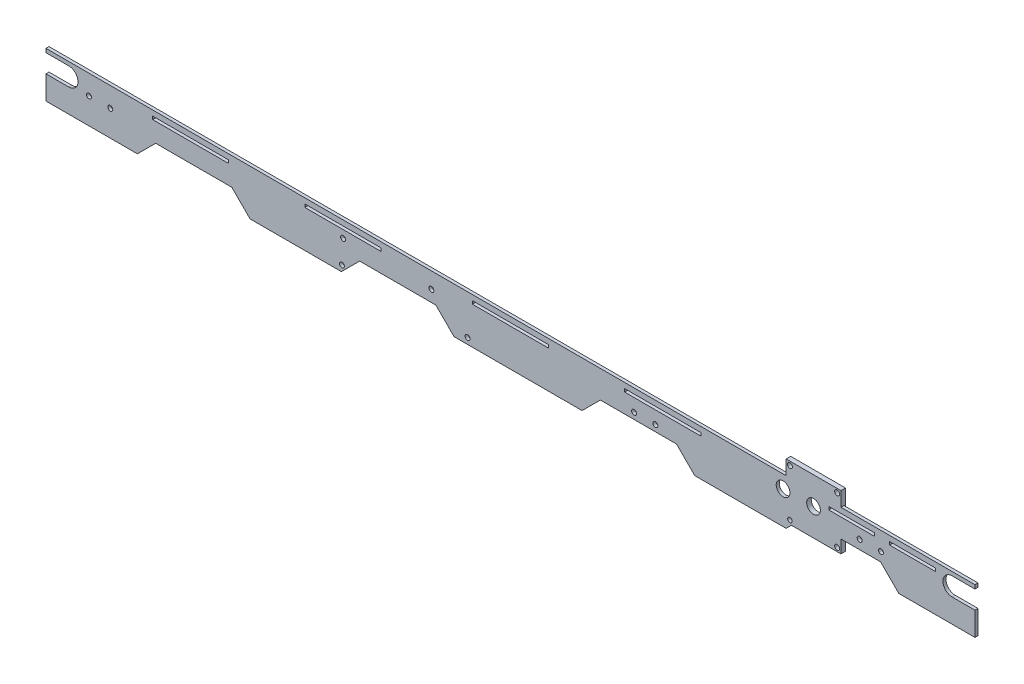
SolidWorks part; units mm, degrees
ref_plane "Front Plane" through (0, 0, 0) normal (0, 0, 1) x (1, 0, 0)
ref_plane "Top Plane" through (0, 0, 0) normal (0, 1, 0) x (1, 0, 0)
ref_plane "Right Plane" through (0, 0, 0) normal (1, 0, 0) x (0, 0, -1)
sketch "Croquis1" plane through (0, 0, 0) normal (0, 0, 1) x (1, 0, 0)
  line L0 (-300, 3) -> (300, 3)
  line L5 (300, 3) -> (300, -27)
  line L6 (300, -27) -> (250, -27)
  line L7 (250, -27) -> (238, -15)
  line L8 (238, -15) -> (188, -15)
  line L9 (188, -15) -> (176, -27)
  line L10 (176, -27) -> (116.02, -27) construction
  line L11 (116.02, -27) -> (104.02, -15)
  line L12 (104.02, -15) -> (54.02, -15)
  line L13 (54.02, -15) -> (42.02, -27)
  line L14 (42.02, -27) -> (-42.02, -27)
  line L15 (0, 0) -> (0, -27) construction
  line L16 (116.02, -27) -> (176, -27)
  line L17 (-176, -27) -> (-116.02, -27) construction
  line L18 (-116.02, -27) -> (-176, -27)
  line L19 (-54.02, -15) -> (-42.02, -27)
  line L20 (-104.02, -15) -> (-54.02, -15)
  line L21 (-116.02, -27) -> (-104.02, -15)
  line L22 (-188, -15) -> (-176, -27)
  line L23 (-238, -15) -> (-188, -15)
  line L24 (-250, -27) -> (-238, -15)
  line L25 (-300, -27) -> (-250, -27)
  line L26 (-300, 3) -> (-300, -27)
  dimension "D1" = 30
  dimension "D2" = 18
  dimension "D3" = 45
  dimension "D4" = 45
  dimension "D5" = 45
  dimension "D6" = 45
  dimension "D7" = 50
  dimension "D8" = 300
  dimension "D9" = 50
  dimension "D10" = 50
  dimension "D11" = 42.02
  dimension "D12" = 59.98
  dimension "D13" = 18
  dimension "D14" = 18
  dimension "D15" = 18
  dimension "D16" = 3
  dimension "D17" = 30
  dimension "D18" = 30
  dimension "D19" = 30
  dimension "D20" = 30
  dimension "D21" = 30
extrude "Saliente-Extruir1" add sketch "Croquis1" along normal blind 2
sketch "Croquis4" plane through (0, 0, 2) normal (0, 0, 1) x (1, 0, 0)
  line L0 (-300, 3) -> (-300, -27) construction
  line L1 (-240, -0.5) -> (-190, -0.5)
  line L2 (-240, -0.5) -> (-240, -2.5)
  line L3 (-240, -2.5) -> (-190, -2.5)
  line L4 (-190, -0.5) -> (-190, -2.5)
  line L5 (-140, -0.5) -> (-90, -0.5)
  line L6 (-140, -0.5) -> (-140, -2.5)
  line L7 (-140, -2.5) -> (-90, -2.5)
  line L8 (-90, -0.5) -> (-90, -2.5)
  line L9 (-30, -0.5) -> (20, -0.5)
  line L10 (-30, -0.5) -> (-30, -2.5)
  line L11 (-30, -2.5) -> (20, -2.5)
  line L12 (20, -0.5) -> (20, -2.5)
  line L13 (70, -0.5) -> (120, -0.5)
  line L14 (70, -0.5) -> (70, -2.5)
  line L15 (70, -2.5) -> (120, -2.5)
  line L16 (120, -0.5) -> (120, -2.5)
  line L17 (120, -1.5) -> (-370.2291, -1.5) construction
  line L18 (300, 3) -> (-300, 3) construction
  dimension "D1" = 2
  dimension "D2" = 60
  dimension "D3" = 50
  dimension "D4" = 50
  dimension "D5" = 50
  dimension "D6" = 50
  dimension "D7" = 50
  dimension "D8" = 50
  dimension "D9" = 60
  dimension "D10" = 3.5
  dimension "D11" = 2
  dimension "D12" = 3.5
  dimension "D13" = 2
  dimension "D14" = 3.5
  dimension "D15" = 2
  dimension "D16" = 3.5
extrude "Cortar-Extruir1" cut sketch "Croquis4" against normal blind 5
sketch "Croquis6" plane through (0, 0, 0) normal (0, 0, -1) x (-1, 0, 0)
  line L0 (-117.3884, -5.5) -> (-221.61, -5.5) construction
  line L2 (-70, -0.5) -> (-120, -0.5) construction
  line L3 (-120, -0.5) -> (-120, -2.5) construction
  circle A0 centre (-194, -5.5) radius 4.5
  dimension "D2" = 9
  dimension "D1" = 5
  dimension "D3" = 74
extrude "Cortar-Extruir3" cut sketch "Croquis6" against normal blind 3
sketch "Croquis7" plane through (0, 0, 2) normal (0, 0, 1) x (1, 0, 0)
  line L0 (178.5, 10) -> (240.5, 10) construction
  line L1 (176, -23.5) -> (212, -23.5)
  line L2 (176, -23.5) -> (176, 12.5)
  line L3 (176, 12.5) -> (212, 12.5)
  line L4 (212, -23.5) -> (212, 12.5)
  line L5 (176, -23.5) -> (212, 12.5) construction
  line L6 (176, 12.5) -> (212, -23.5) construction
  line L7 (212, 20.7798) -> (212, -35.4655) construction
  circle A0 centre (194, -5.5) radius 4.5
  circle A1 centre (194, -5.5) radius 4.5 construction
  circle A2 centre (178.5, 10) radius 1.625
  circle A3 centre (209.5, 10) radius 1.625
  circle A5 centre (209.5, -21) radius 1.625
  circle A7 centre (178.5, -21) radius 1.625
  point P2 (194, -5.5)
  dimension "D1" = 36
  dimension "D3" = 31
  dimension "D4" = 3.25
  dimension "D5" = 3.25
  dimension "D6" = 31
  dimension "D2" = 36
  dimension "D7" = 31
  dimension "D8" = 31
extrude "Saliente-Extruir2" add sketch "Croquis7" against normal blind 3
sketch "Croquis8" plane through (0, 0, 2) normal (0, 0, 1) x (1, 0, 0)
  line L0 (194, -5.5) -> (137.4416, -5.5) construction
  line L3 (231.4504, 47.2218) -> (231.4504, -51.8002) construction
  circle A0 centre (178.5, 10) radius 1.5
  circle A1 centre (194, -5.5) radius 3.6
  circle A2 centre (178.5, -21) radius 1.5
extrude "Cortar-Extruir4" cut sketch "Croquis8" against normal blind 3
sketch "Croquis10" plane through (0, 0, 2) normal (0, 0, 1) x (1, 0, 0)
  line L1 (-300, 3) -> (-310, 3)
  line L2 (-300, 3) -> (-300, -27)
  line L3 (-300, -27) -> (-310, -27)
  line L4 (-310, 3) -> (-310, -27)
  dimension "D1" = 10
  dimension "D2" = 30
extrude "Saliente-Extruir3" add sketch "Croquis10" against normal blind 2
sketch "Croquis20" plane through (0, 0, 0) normal (0, 0, -1) x (-1, 0, 0)
  circle A0 centre (114.9351, -7.5) radius 1.625
  circle A1 centre (56.9351, -7.5) radius 1.625
  dimension "D1" = 3.25
  dimension "D2" = 3.25
extrude "Cortar-Extruir15" cut sketch "Croquis20" against normal blind 10
sketch "Croquis21" plane through (0, 0, 0) normal (0, 0, -1) x (-1, 0, 0)
  line L0 (-90.1377, -10.8839) -> (-76.1377, -10.8839) construction
  circle A0 centre (-76.1377, -10.8839) radius 1.625
  circle A1 centre (-90.1377, -10.8839) radius 1.625
  dimension "D1" = 3.25
  dimension "D2" = 3.25
  dimension "D3" = 14
extrude "Cortar-Extruir16" cut sketch "Croquis21" against normal blind 3
sketch "Croquis22" plane through (0, 0, 2) normal (0, 0, 1) x (1, 0, 0)
  circle A0 centre (224.2734, -9) radius 1.625
  circle A1 centre (238.2734, -9) radius 1.625
  dimension "D1" = 3.25
  dimension "D2" = 3.25
extrude "Cortar-Extruir17" cut sketch "Croquis22" against normal blind 3
sketch "Croquis23" plane through (0, 0, 2) normal (0, 0, 1) x (1, 0, 0)
  line L0 (-281.7723, -10) -> (-267.7723, -10) construction
  line L1 (176, 3) -> (-310, 3) construction
  circle A0 centre (-281.7723, -10) radius 1.625
  circle A1 centre (-267.7723, -10) radius 1.625
  dimension "D1" = 3.25
  dimension "D2" = 3.25
  dimension "D3" = 13
extrude "Cortar-Extruir18" cut sketch "Croquis23" against normal blind 3
sketch "Croquis25" plane through (0, 0, 2) normal (0, 0, 1) x (1, 0, 0)
  line L0 (-295, 0.5) -> (-310, 0.5)
  line L1 (-310, 3) -> (-310, -27) construction
  line L2 (-310, 0.5) -> (-310, -11.5)
  line L3 (-310, -11.5) -> (-295, -11.5)
  line L4 (-190, -0.5) -> (-240, -0.5) construction
  line L5 (-5, 29.772) -> (-5, -143.3003) construction
  line L7 (300, -11.5) -> (285, -11.5)
  line L8 (300, 0.5) -> (300, -11.5)
  line L9 (285, 0.5) -> (300, 0.5)
  arc A0 (-295, -11.5) -> (-295, 0.5) centre (-295, -5.5) ccw
  arc A1 (285, -11.5) -> (285, 0.5) centre (285, -5.5) cw
  point P1 (-289, -5.5)
  point P19 (279, -5.5)
  dimension "D1" = 12
  dimension "D2" = 15
  dimension "D3" = 21
  dimension "D4" = 5
  dimension "D5" = 5
extrude "Cortar-Extruir20" cut sketch "Croquis25" against normal blind 3
sketch "Croquis27" plane through (0, 0, 2) normal (0, 0, 1) x (1, 0, 0)
  circle A0 centre (174, -5.5) radius 4.5
  dimension "D1" = 9
extrude "Cortar-Extruir21" cut sketch "Croquis27" against normal blind 3
sketch "Croquis28" plane through (0, 0, 0) normal (0, 0, -1) x (-1, 0, 0)
  line L0 (-204, -1.5) -> (-303.6264, -1.5) construction
  line L1 (-274, -0.5) -> (-244, -0.5)
  line L2 (-274, -0.5) -> (-274, -2.5)
  line L3 (-274, -2.5) -> (-244, -2.5)
  line L4 (-244, -0.5) -> (-244, -2.5)
  line L5 (-234, -0.5) -> (-204, -0.5)
  line L6 (-234, -0.5) -> (-234, -2.5)
  line L7 (-234, -2.5) -> (-204, -2.5)
  line L8 (-204, -0.5) -> (-204, -2.5)
  dimension "D1" = 2
  dimension "D2" = 2
  dimension "D3" = 30
  dimension "D4" = 30
  dimension "D5" = 10
  dimension "D6" = 2
  dimension "D7" = 1
  dimension "D8" = 1
  dimension "D9" = 2
extrude "Cortar-Extruir22" cut sketch "Croquis28" against normal blind 3
sketch "Sketch1" plane through (0, 0, 0) normal (0, 0, -1) x (-1, 0, 0)
  circle A0 centre (33.1907, -23) radius 1.6
  circle A1 centre (115.6502, -23) radius 1.6
  dimension "D1" = 3.2
  dimension "D2" = 3.2
extrude "Cut-Extrude1" cut sketch "Sketch1" against normal blind 5
